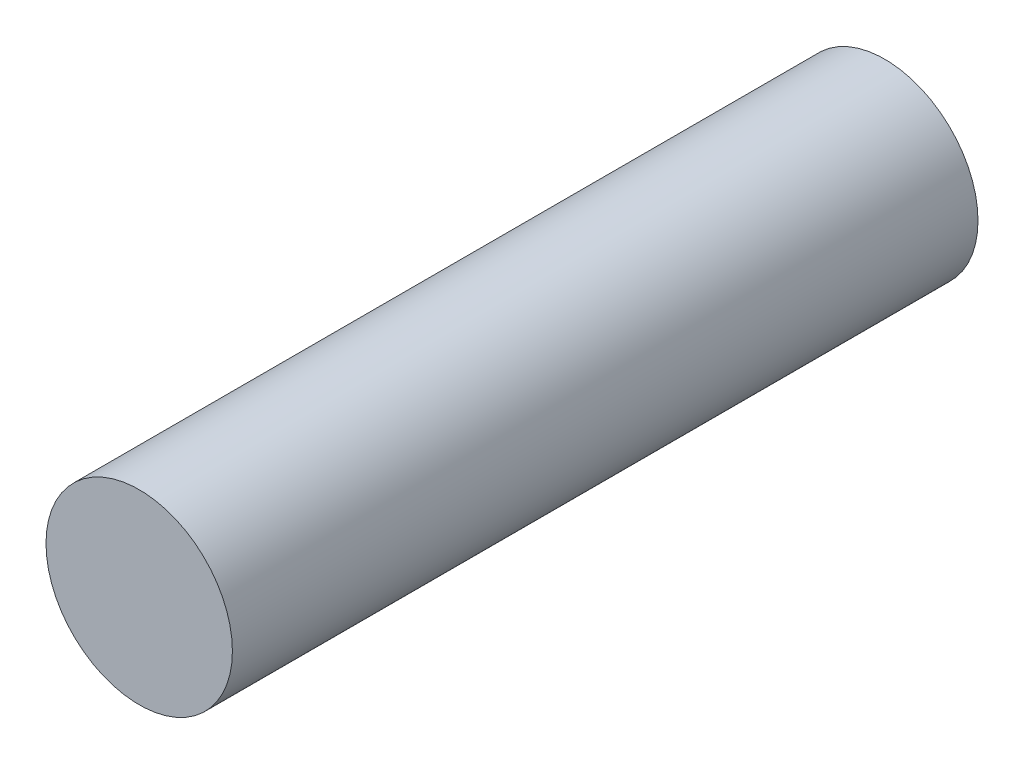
SolidWorks part; units mm, degrees
ref_plane "Plano frontal" through (0, 0, 0) normal (0, 0, 1) x (1, 0, 0)
ref_plane "Plano superior" through (0, 0, 0) normal (0, 1, 0) x (1, 0, 0)
ref_plane "Plano direito" through (0, 0, 0) normal (1, 0, 0) x (0, 0, -1)
sketch "Esboço1" plane through (0, 0, 0) normal (0, 0, 1) x (1, 0, 0)
  circle A0 centre (0, 0) radius 0.75
  dimension "D1" = 1.5
extrude "Ressalto-extrusão1" add sketch "Esboço1" along normal blind 6
